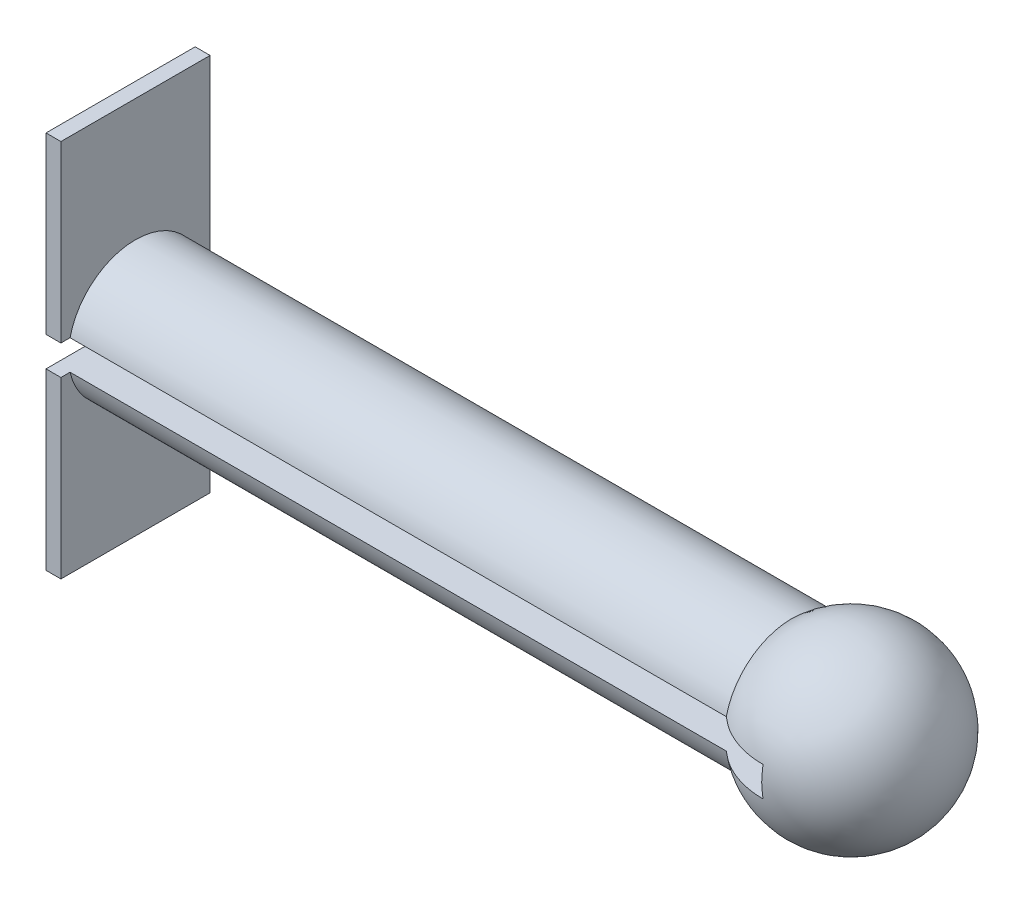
SolidWorks part; units mm, degrees
ref_plane "Plan1" through (0, 0, 0) normal (0, 0, 1) x (1, 0, 0)
ref_plane "Plan2" through (0, 0, 0) normal (0, 1, 0) x (1, 0, 0)
ref_plane "Plan3" through (0, 0, 0) normal (1, 0, 0) x (0, 0, -1)
sketch "Esquisse1" plane through (0, 0, 0) normal (0, 0, 1) x (1, 0, 0)
  line L0 (0, 2.25) -> (22, 2.25)
  line L1 (0, 2.25) -> (0, 0)
  line L2 (0, 0) -> (22, 0)
  line L3 (22, 0) -> (22, 2.25)
  line L4 (20, 0) -> (0, 0) construction
  dimension "D1" = 2.25
  dimension "D2" = 22
revolve "Base-Révolution" add sketch "Esquisse1" angle 360 about L4
dome "Dôme1" faces to dome 1 distance 5 parameters "D1"=5
sketch "Esquisse2" plane through (0, 0, 0) normal (0, 0, 1) x (1, 0, 0)
  line L0 (0, -6.35) -> (-0.5, -6.35)
  line L2 (0, -6.35) -> (0, 6.35)
  line L3 (0, 6.35) -> (-0.5, 6.35)
  line L4 (-0.5, -6.35) -> (-0.5, 6.35)
  dimension "D2" = 0.5
  dimension "D3" = 12.7
extrude "Boss.-Extru.1" add sketch "Esquisse2" along normal mid plane 5
sketch "Esquisse3" plane through (0, 0, 0) normal (0, 0, 1) x (1, 0, 0)
  line L0 (22, 2.25) -> (22, -2.25) construction
  line L1 (-8, 0.5) -> (24, 0.5)
  line L2 (-8, 0.5) -> (-8, -0.5)
  line L3 (-8, -0.5) -> (24, -0.5)
  line L4 (24, 0.5) -> (24, -0.5)
  dimension "D1" = 30
  dimension "D2" = 32
  dimension "D3" = 1
  dimension "D4" = 0.5
extrude "Enlèv. mat.-Extru.1" cut sketch "Esquisse3" against normal mid plane 50
